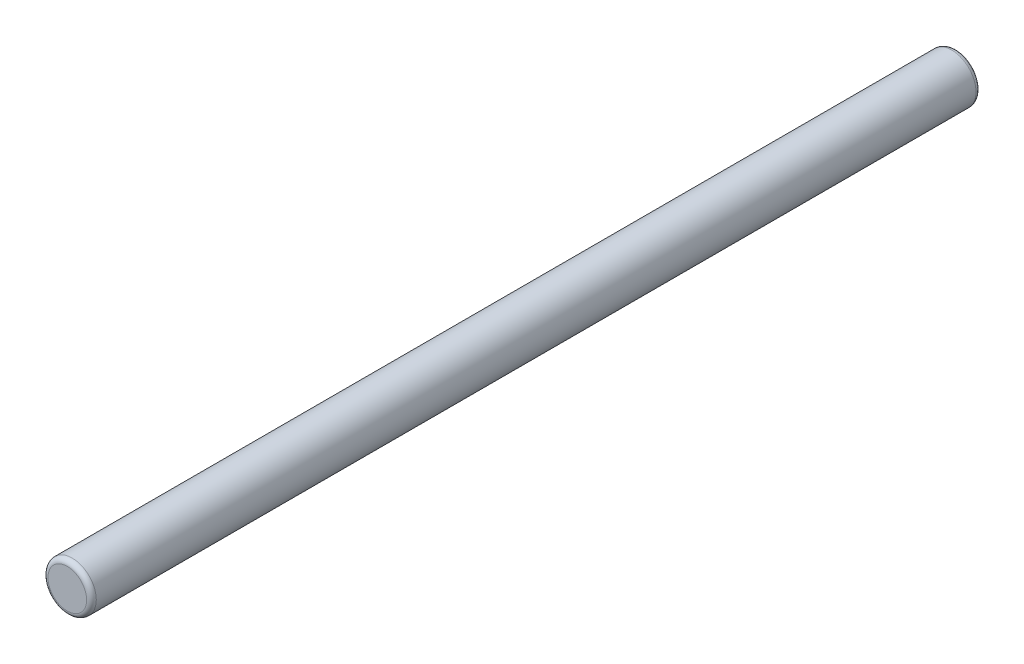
SolidWorks part; units mm, degrees
ref_plane "Plan de face" through (0, 0, 0) normal (0, 0, 1) x (1, 0, 0)
ref_plane "Plan de dessus" through (0, 0, 0) normal (0, 1, 0) x (1, 0, 0)
ref_plane "Plan de droite" through (0, 0, 0) normal (1, 0, 0) x (0, 0, -1)
sketch "Esquisse1" plane through (0, 0, 0) normal (0, 0, 1) x (1, 0, 0)
  circle A0 centre (0, 0) radius 1
  dimension "D1" = 2
extrude "Extrusion1" add sketch "Esquisse1" against normal blind 36.8
fillet "Congé1" radius 0.2 2 edges at (1, 0, 0) (1, 0, -36.8)
